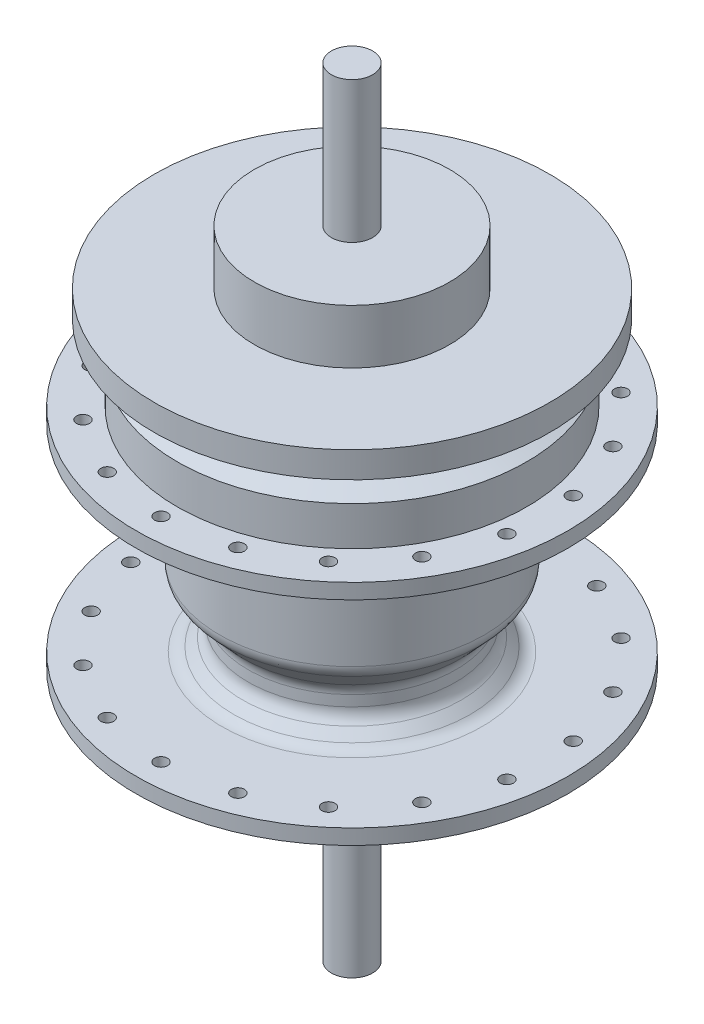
SolidWorks part; units mm, degrees
ref_plane "Front Plane" through (0, 0, 0) normal (0, 0, 1) x (1, 0, 0)
ref_plane "Top Plane" through (0, 0, 0) normal (0, 1, 0) x (1, 0, 0)
ref_plane "Right Plane" through (0, 0, 0) normal (1, 0, 0) x (0, 0, -1)
sketch "Sketch1" plane through (0, 0, 0) normal (0, 0, 1) x (1, 0, 0)
  line L0 (0, 84.6375) -> (-4.75, 84.6375)
  line L1 (-4.75, 84.6375) -> (-4.75, 52.1375)
  line L2 (-4.75, 52.1375) -> (-22.5, 52.1375)
  line L3 (-22.5, 52.1375) -> (-22.5, 39.6375)
  line L4 (-22.5, 39.6375) -> (-45.565, 39.6375)
  line L5 (-45.565, 39.6375) -> (-45.565, 33.6375)
  line L6 (-45.565, 33.6375) -> (-22.5, 33.6375)
  line L7 (0, 84.6375) -> (0, -94.6125)
  line L8 (-22.5, 33.6375) -> (-31, 30.8375)
  line L9 (-31, 30.8375) -> (-31, 28.6375)
  line L10 (-31, 28.6375) -> (-40.25, 25.1375)
  line L11 (-40.25, 25.1375) -> (-40.25, 16.1375)
  line L12 (-40.25, 16.1375) -> (-49.75, 16.1375)
  line L13 (-49.75, 16.1375) -> (-49.75, 12.6375)
  line L14 (-49.75, 12.6375) -> (-39.75, 12.6375)
  line L15 (-39.75, 12.6375) -> (-30.4875, 2.6375)
  line L16 (-30.4875, 2.6375) -> (-30.4875, -15.8625)
  line L17 (-30.4875, -15.8625) -> (-23.917, -22.9562)
  line L18 (-23.917, -22.9562) -> (-23.917, -28.7294)
  line L19 (-23.917, -28.7294) -> (-28.3791, -32.8625)
  line L20 (-28.3791, -32.8625) -> (-49.75, -32.8625)
  line L21 (-49.75, -32.8625) -> (-49.75, -36.3625)
  line L22 (-49.75, -36.3625) -> (-32, -36.3625)
  line L23 (-32, -36.3625) -> (-30.5176, -40.8625)
  line L24 (-30.5176, -40.8625) -> (-17.7, -40.8625)
  line L25 (-17.7, -40.8625) -> (-17.7, -47.3625)
  line L26 (-17.7, -47.3625) -> (-7.6, -47.3625)
  line L27 (-4.75, -59.6125) -> (-4.75, -94.6125)
  line L28 (-4.75, -94.6125) -> (0, -94.6125)
  line L29 (0, 84.6375) -> (0, -94.6125) construction
  line L32 (-4.75, -59.6125) -> (-7.6, -59.6125)
  line L33 (-7.6, -47.3625) -> (-7.6, -59.6125)
  dimension "D1" = 9.5
  dimension "D2" = 32.5
  dimension "D3" = 12.5
  dimension "D4" = 45
  dimension "D5" = 91.13
  dimension "D6" = 6
  dimension "D7" = 3.5
  dimension "D8" = 62
  dimension "D9" = 2.2
  dimension "D10" = 80.5
  dimension "D11" = 99.5
  dimension "D12" = 9
  dimension "D13" = 3.5
  dimension "D14" = 17.5
  dimension "D15" = 10
  dimension "D16" = 10
  dimension "D17" = 18.5
  dimension "D18" = 17
  dimension "D19" = 64
  dimension "D20" = 4.5
  dimension "D21" = 35.4
  dimension "D22" = 6.5
  dimension "D23" = 15.2
  dimension "D24" = 35
  dimension "D25" = 12.25
revolve "Revolve1" add sketch "Sketch1" angle 360 about L29
sketch "Sketch2" plane through (0, -36.3625, 0) normal (0, -1, 0) x (1, 0, 0)
  circle A0 centre (0, 44) radius 1.5
  dimension "D1" = 44
extrude "Cut-Extrude1" cut sketch "Sketch2" against normal blind 60
pattern_circular "CirPattern1" count 18 over 360 about axis through (0, 0, 0) along (0, 1, 0) of "Cut-Extrude1"
fillet "Fillet1" radius 4 6 edges at (-39.75, 12.6375, 0) (-28.3791, -32.8625, 0) (-30.4875, 2.6375, 0) (-30.4875, -15.8625, 0) (-23.917, -22.9562, 0) (-23.917, -28.7294, 0)
